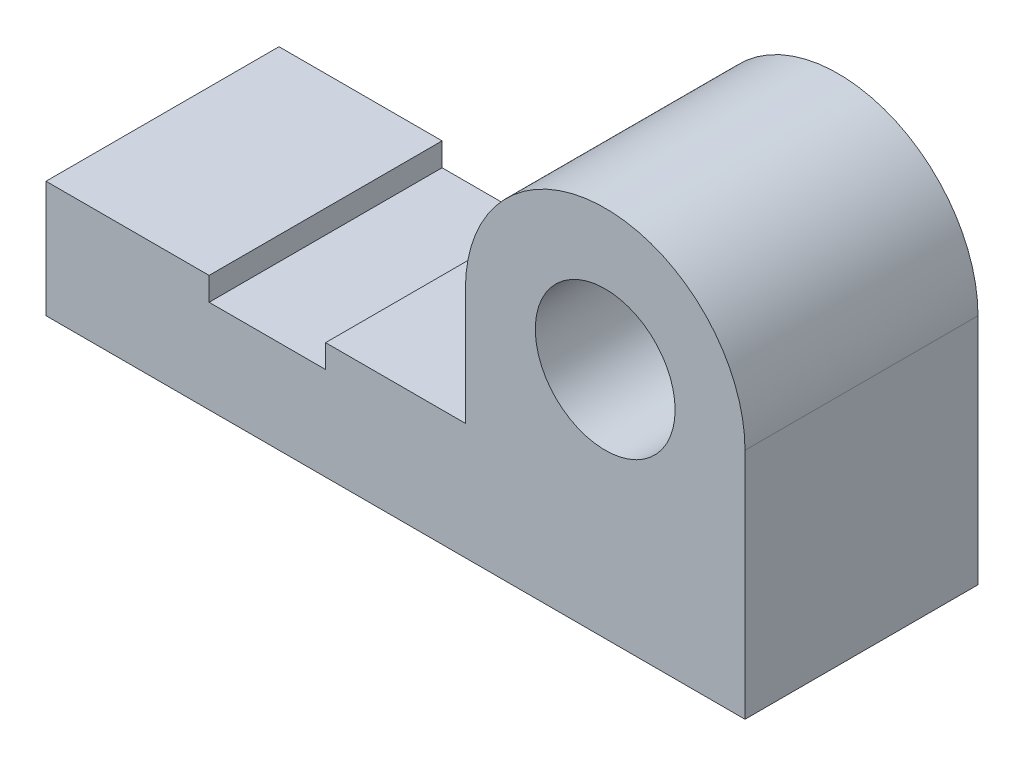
SolidWorks part; units mm, degrees
ref_plane "Front Plane" through (0, 0, 0) normal (0, 0, 1) x (1, 0, 0)
ref_plane "Top Plane" through (0, 0, 0) normal (0, 1, 0) x (1, 0, 0)
ref_plane "Right Plane" through (0, 0, 0) normal (1, 0, 0) x (0, 0, -1)
sketch "Sketch1" plane through (0, 0, 0) normal (0, 0, 1) x (1, 0, 0)
  line L0 (0, 0) -> (150, 0)
  line L1 (150, 0) -> (150, 50)
  line L2 (90, 50) -> (90, 25)
  line L3 (90, 25) -> (60, 25)
  line L4 (60, 25) -> (60, 20)
  line L5 (60, 20) -> (35, 20)
  line L6 (35, 20) -> (35, 25)
  line L7 (35, 25) -> (0, 25)
  line L8 (0, 25) -> (0, 0)
  arc A0 (150, 50) -> (90, 50) centre (120, 50) ccw
  circle A1 centre (120, 50) radius 15
  dimension "D3" = 30
  dimension "D4" = 30
  dimension "D1" = 150
  dimension "D2" = 50
  dimension "D5" = 25
  dimension "D6" = 35
  dimension "D7" = 25
  dimension "D8" = 5
extrude "Boss-Extrude1" add sketch "Sketch1" along normal blind 50
equation "\"D3@Sketch1\" = \"D1@Sketch1\" / 5 ' Radius"
equation "\"D4@Sketch1\" = \"D1@Sketch1\" / 5 ' Diameter"
equation "\"D5@Sketch1\" = \"D1@Sketch1\" / 6 ' Height"
equation "\"D2@Sketch1\" = \"D1@Sketch1\" / 3 ' Hole Location"
equation "\"D6@Sketch1\" = \"D1@Sketch1\" / 30 * 7 ' Slot Location"
equation "\"D7@Sketch1\" = \"D1@Sketch1\" / 6 ' Slot"
equation "\"D8@Sketch1\" = \"D1@Sketch1\" / 30 ' Slot Depth"
equation "\"D1@Boss-Extrude1\" = \"D1@Sketch1\" / 3 ' Extrude"
